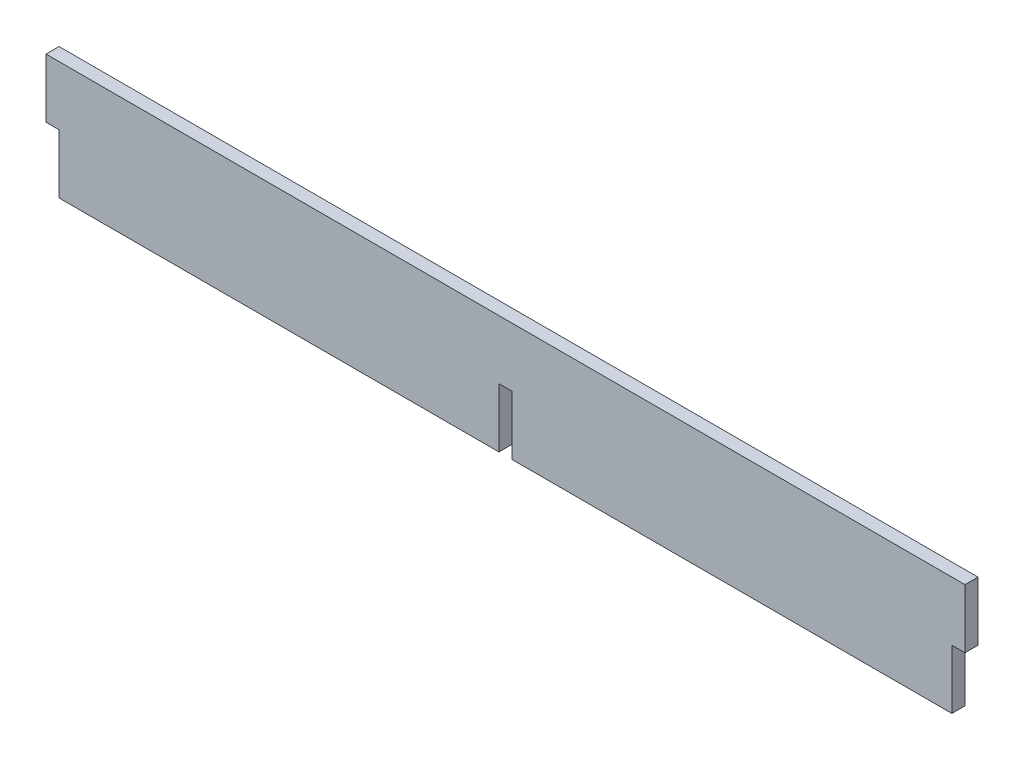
SolidWorks part; units mm, degrees
ref_plane "Front Plane" through (0, 0, 0) normal (0, 0, 1) x (1, 0, 0)
ref_plane "Top Plane" through (0, 0, 0) normal (0, 1, 0) x (1, 0, 0)
ref_plane "Right Plane" through (0, 0, 0) normal (1, 0, 0) x (0, 0, -1)
sketch "Sketch1" plane through (0, 0, 0) normal (0, 0, 1) x (1, 0, 0)
  line L0 (114.315, 0) -> (222.225, 0)
  line L1 (3.2, 0) -> (111.115, 0)
  line L2 (0, 14.49) -> (0, 28.97)
  line L3 (0, 28.97) -> (225.425, 28.97)
  line L4 (225.425, 14.49) -> (225.425, 28.97)
  line L7 (0, 14.49) -> (3.2, 14.49)
  line L8 (3.2, 0) -> (3.2, 14.49)
  line L10 (111.115, 0) -> (111.115, 14.49)
  line L11 (111.115, 14.49) -> (114.315, 14.49)
  line L12 (114.315, 0) -> (114.315, 14.49)
  line L15 (225.425, 14.49) -> (222.225, 14.49)
  line L16 (222.225, 0) -> (222.225, 14.49)
  dimension "D2" = 3.2
  dimension "D3" = 3.2
  dimension "D4" = 3.2
  dimension "D5" = 14.48
  dimension "D6" = 28.97
  dimension "D7" = 14.48
  dimension "D8" = 14.48
  dimension "D9" = 107.915
extrude "Boss-Extrude1" add sketch "Sketch1" along normal blind 3.2 contours L3 L4 L15 L16 L0 L12 L11 L10 L1 L8 L7 L2
